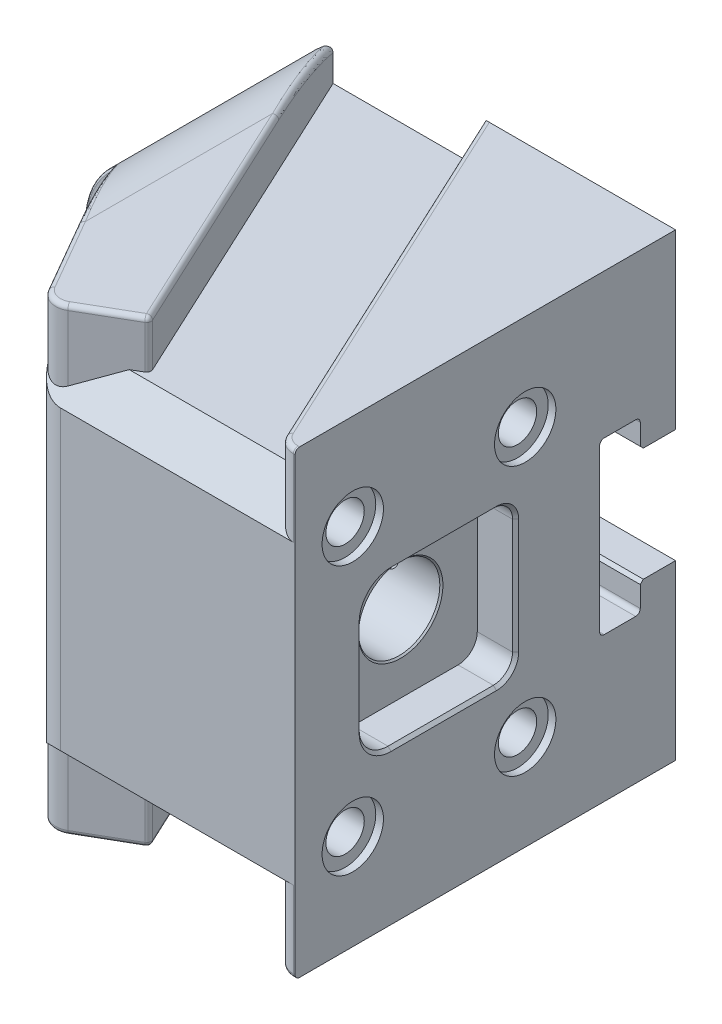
SolidWorks part; units mm, degrees
ref_plane "Front Plane" through (0, 0, 0) normal (0, 0, 1) x (1, 0, 0)
ref_plane "Top Plane" through (0, 0, 0) normal (0, 1, 0) x (1, 0, 0)
ref_plane "Right Plane" through (0, 0, 0) normal (1, 0, 0) x (0, 0, -1)
sketch "Sketch1" plane through (0, 0, 0) normal (1, 0, 0) x (0, 0, -1)
  line L1 (0, 38.0365) -> (-63.5, 38.0365)
  line L2 (-13.081, -14.097) -> (-13.081, 14.097)
  line L3 (-63.5, 38.0365) -> (-63.5, -38.0365)
  line L5 (-25.4931, 0) -> (10.3829, 0) construction
  line L6 (34.925, 0) -> (-34.925, 0) construction
  line L7 (0, 38.0365) -> (0, 9.398)
  line L8 (0, 9.398) -> (-6.35, 9.398)
  line L9 (-6.35, 9.398) -> (-6.35, 14.097)
  line L10 (-6.35, 14.097) -> (-13.081, 14.097)
  line L11 (-6.35, -9.398) -> (-6.35, -14.097)
  line L12 (-6.35, -14.097) -> (-13.081, -14.097)
  line L13 (0, -9.398) -> (-6.35, -9.398)
  line L15 (-31.814, -38.0365) -> (-63.5, -38.0365)
  line L16 (0, -9.398) -> (0, -38.0365)
  line L17 (0, -38.0365) -> (-31.814, -38.0365)
  line L18 (0, 34.925) -> (0, -34.925) construction
  dimension "D1" = 13.081
  dimension "D2" = 63.5
  dimension "D3" = 28.194
  dimension "D4" = 6.35
  dimension "D5" = 18.796
  dimension "D6" = 76.073
  dimension "D7" = 38.0365
extrude "Extrude1" add sketch "Sketch1" against normal blind 63.5
sketch "Sketch2" plane through (0, 0, 0) normal (0, 1, 0) x (1, 0, 0)
  line L0 (-67.4703, -34.925) -> (-58.568, -34.925)
  line L1 (-58.568, -34.925) -> (-42.0703, -63.5)
  line L2 (-42.0703, -63.5) -> (-67.4703, -63.5)
  line L3 (-67.4703, -63.5) -> (-67.4703, -34.925)
  line L4 (-63.5, -63.5) -> (0, -63.5) construction
  line L5 (-63.5, 0) -> (0, 0) construction
  line L7 (-58.568, -34.925) -> (-78.5624, -0.2938) construction
  line L8 (-63.5, -5.5753) -> (-63.5, 4.1784) construction
  line L10 (0, -63.5) -> (0, 0) construction
  circle A0 centre (-69.0753, -5.5753) radius 5.5753 construction
  dimension "D5" = 11.1506
  dimension "D1" = 63.5
  dimension "D2" = 120
  dimension "D3" = 28.575
  dimension "D4" = 25.4
extrude "Cut-Extrude1" cut sketch "Sketch2" against normal mid plane 76.2
sketch "Sketch3" plane through (0, 0, 13.081) normal (0, 0, -1) x (-1, 0, 0)
  line L0 (0, -38.0365) -> (0, -9.398) construction
  line L1 (34.925, 0) -> (-34.925, 0) construction
  circle A0 centre (19.05, 0) radius 9.525
  dimension "D1" = 19.05
  dimension "D2" = 19.05
extrude "Cut-Extrude2" cut sketch "Sketch3" against normal blind 12.7
sketch "Sketch4" plane through (0, 0, 13.081) normal (0, 0, -1) x (-1, 0, 0)
  circle A0 centre (19.05, 0) radius 9.525 construction
  circle A1 centre (19.05, 0) radius 9.525
extrude "Cut-Extrude3" cut sketch "Sketch4" along normal blind 33.02
sketch "Sketch5" plane through (0, 0, 25.781) normal (0, 0, -1) x (-1, 0, 0)
  line L0 (19.05, 7.8891) -> (19.05, -9.3784) construction
  line L1 (34.925, 0) -> (-34.925, 0) construction
  line L2 (0, -14.097) -> (0, 14.097) construction
  circle A0 centre (15.24, 0) radius 1.7272
  circle A1 centre (22.86, 0) radius 1.7272
  dimension "D2" = 3.4544
  dimension "D1" = 19.05
  dimension "D3" = 3.81
extrude "Cut-Extrude4" cut sketch "Sketch5" against normal blind 8.636
sketch "Sketch6" plane through (0, 0, 0) normal (0, 1, 0) x (1, 0, 0)
  line L0 (-18.9934, -39.6748) -> (-43.2874, -39.6748) construction
  line L2 (-31.1404, -32.9311) -> (-31.1404, -29.3624)
  line L3 (-31.1404, -29.3624) -> (-68.8805, -29.3624)
  line L4 (-68.8805, -29.3624) -> (-68.8805, -39.6748)
  line L5 (-31.1404, -32.9311) -> (0, -32.9311)
  line L6 (0, -32.9311) -> (0, -39.6748)
  line L7 (0, -39.6748) -> (-68.8805, -39.6748)
  line L9 (0, -63.5) -> (0, 0) construction
  line L10 (-42.0703, -63.5) -> (0, -63.5) construction
  dimension "D1" = 23.8252
  dimension "D2" = 68.8805
  dimension "D3" = 20.6248
  dimension "D4" = 13.4874
  dimension "D5" = 31.1404
revolve "Cut-Revolve1" cut sketch "Sketch6" angle 360 about L0
fillet "Fillet1" radius 0.762 4 edges at (-31.75, 14.097, 6.35) (-31.75, -14.097, 6.35) (-31.75, -14.097, 13.081) (-31.75, 14.097, 13.081)
chamfer "Chamfer1" distance 0.508 angle 45 4 edges at (-42.0501, 9.398, 6.35) (-42.0501, 9.398, 0) (-42.0501, -9.398, 0) (-42.0501, -9.398, 6.35)
sketch "Sketch8" plane through (0, 38.0365, 0) normal (0, 1, 0) x (1, 0, 0)
  line L0 (-2.2944, -63.5) -> (-33.0894, 2.54)
  line L1 (-33.0894, 2.54) -> (-58.3966, 2.54)
  line L2 (-58.3966, 2.54) -> (-30.8102, -56.6193)
  line L3 (-42.7279, -63.5) -> (-2.2944, -63.5)
  line L4 (0, -63.5) -> (0, 0) construction
  line L5 (-42.0703, -63.5) -> (0, -63.5) construction
  line L6 (-30.8102, -56.6193) -> (-42.7279, -63.5)
  line L7 (-63.5, 0) -> (0, 0) construction
  line L8 (0, 0) -> (0, -63.5) construction
  line L9 (-19.05, -5.0025) -> (-19.05, 7.814) construction
  circle A0 centre (-24.0525, -5.0025) radius 5.0025 construction
  dimension "D7" = 10.0051
  dimension "D8" = 2.2944
  dimension "D1" = 25
  dimension "D2" = 66.04
  dimension "D3" = 30.8102
  dimension "D4" = 22.9362
  dimension "D5" = 30
  dimension "D6" = 19.05
extrude "Cut-Extrude6" cut sketch "Sketch8" against normal blind 7.874
mirror "Mirror1" about plane through (0, 0, 0) normal (0, 1, 0) of "Cut-Extrude6"
fillet "Fillet5" radius 0.762 2 edges at (-30.8102, 34.0995, 56.6193) (-30.8102, -34.0995, 56.6193)
chamfer "Chamfer2" distance 5.588 angle 45 2 edges at (-22.1823, -30.1625, 63.5) (-22.1823, 30.1625, 63.5)
fillet "Fillet6" radius 3.175 2 edges at (-2.2944, -31.3055, 63.5) (-2.2944, 31.3055, 63.5)
sketch "Sketch9" plane through (0, 0, 0) normal (1, 0, 0) x (0, 0, -1)
  line L0 (-52.3875, 12.7) -> (-26.9875, 12.7)
  line L1 (-26.9875, 12.7) -> (-26.9875, -12.7)
  line L2 (-26.9875, -12.7) -> (-52.3875, -12.7)
  line L3 (-52.3875, -12.7) -> (-52.3875, 12.7)
  line L4 (34.925, 0) -> (-34.925, 0) construction
  dimension "D1" = 25.4
  dimension "D2" = 25.4
  dimension "D3" = 12.7
  dimension "D4" = 26.9875
extrude "Cut-Extrude7" cut sketch "Sketch9" against normal blind 6.35
fillet "Fillet8" radius 13.462 2 edges at (-63.5, -38.0365, 17.4625) (-63.5, 38.0365, 17.4625)
chamfer "Chamfer3" distance 0.508 angle 45 8 edges at (0, -23.9712, 0) (-15.9525, -38.0365, 0) (-61.8237, -31.0801, 0) (-63.5, -17.2402, 0) (0, 23.9712, 0) (-63.5, 17.2403, 0) (-61.8237, 31.0801, 0) (-15.9525, 38.0365, 0)
fillet "Fillet10" radius 0.381 4 edges at (-62.2047, -30.3362, 34.925) (-62.2047, 30.3362, 34.925) (-63.5, -16.864, 34.925) (-63.5, 16.864, 34.925)
fillet "Fillet11" radius 0.127 4 edges at (-58.6326, 34.7907, 34.8132) (-58.6338, -34.7925, 34.811) (-58.568, 21.8226, 34.925) (-58.568, -21.8226, 34.925)
fillet "Fillet12" radius 3.175 2 edges at (-3.175, -12.7, 26.9875) (-3.175, 12.7, 26.9875)
chamfer "Chamfer5" distance 0.254 angle 45 1 edges at (-6.35, 0, 46.4185)
fillet "Fillet13" radius 4.7752 2 edges at (-3.175, 12.7, 52.3875) (-3.175, -12.7, 52.3875)
ref_plane "Plane1" through (0, -22.225, 0) normal (0, 1, 0) x (-1, 0, 0)
sketch "Sketch11" plane through (0, -22.225, 0) normal (0, 1, 0) x (-1, 0, 0)
  line L0 (13.97, 51.9073) -> (13.97, -7.1622) construction
  line L1 (0, 63.5) -> (0, 0.508) construction
  line L2 (13.97, 58.4023) -> (18.3388, 55.88)
  line L3 (18.3388, 55.88) -> (18.3388, -5.9689)
  line L4 (18.3388, -5.9689) -> (13.97, -5.9689)
  line L5 (13.97, -5.9689) -> (13.97, 58.4023)
  line L7 (0.508, 0) -> (31.9049, 0) construction
  dimension "D1" = 13.97
  dimension "D2" = 8.7376
  dimension "D3" = 55.88
  dimension "D4" = 120
  dimension "D5" = 64.3712
revolve "Cut-Revolve2" cut sketch "Sketch11" angle 360 about L0
mirror "Mirror2" about plane through (0, 0, 0) normal (0, 1, 0) of "Cut-Revolve2"
sketch "Sketch12" plane through (0, -22.225, 0) normal (0, 1, 0) x (-1, 0, 0)
  line L0 (72.3809, 25.4) -> (5.3464, 25.4) construction
  line L1 (77.5927, 39.6748) -> (-16.2197, 39.6748) construction
  line L2 (42.0703, 63.5) -> (0.2717, 63.5) construction
  line L3 (70.5837, 21.0312) -> (13.97, 21.0312)
  line L4 (13.97, 21.0312) -> (13.97, 25.4)
  line L5 (13.97, 25.4) -> (70.5837, 25.4)
  line L6 (70.5837, 25.4) -> (70.5837, 21.0312)
  line L7 (0, 63.5) -> (0, 0.508) construction
  dimension "D1" = 23.8252
  dimension "D2" = 14.2748
  dimension "D3" = 8.7376
  dimension "D4" = 13.97
  dimension "D5" = 56.6137
revolve "Cut-Revolve3" cut sketch "Sketch12" angle 360 about L0
mirror "Mirror3" about plane through (0, 0, 0) normal (0, 1, 0) of "Cut-Revolve3"
sketch "Sketch14" plane through (0, 0, 0) normal (1, 0, 0) x (0, 0, -1)
  line L0 (34.925, 0) -> (-34.925, 0) construction
  circle A0 centre (-25.4, 22.225) radius 3.175
  circle A1 centre (-39.6748, 0) radius 6.9977 construction
  circle A2 centre (-53.9496, 22.225) radius 3.175
  dimension "D1" = 14.2748
  dimension "D3" = 6.35
  dimension "D5" = 6.35
  dimension "D2" = 22.225
  dimension "D4" = 14.2748
  dimension "D6" = 22.225
extrude "Cut-Extrude8" cut sketch "Sketch14" against normal blind 13.97
mirror "Mirror4" about plane through (0, 0, 0) normal (0, 1, 0) of "Cut-Extrude8"
sketch "Sketch15" plane through (0, 0, 0) normal (1, 0, 0) x (0, 0, -1)
  circle A1 centre (-25.4, 22.225) radius 5.08
  circle A2 centre (-53.9496, 22.225) radius 5.08
  dimension "D1" = 10.16
  dimension "D2" = 10.16
extrude "Cut-Extrude9" cut sketch "Sketch15" against normal blind 1.27
mirror "Mirror5" about plane through (0, 0, 0) normal (0, 1, 0) of "Cut-Extrude9"
fillet "Fillet14" radius 3.175 2 edges at (-42.2347, 31.4479, 63.2152) (-42.2347, -31.4479, 63.2152)
fillet "Fillet15" radius 5.5626 1 edges at (-42.0703, 0, 63.5)
fillet "Fillet16" radius 0.762 22 edges at (-0.1358, -38.0365, 63.5) (-1.9776, -38.0365, 63.0028) (-53.6378, -37.5463, 7.6655) (-58.7822, -34.81, 34.601) (-54.642, -37.2247, 41.7251) (-46.9301, -38.0365, 55.0825) (-41.8943, -38.0365, 61.9449) (-35.45, -38.0365, 59.2981) (-31.0692, -38.0365, 56.5377) (-0.1358, 38.0365, 63.5) (-1.9776, 38.0365, 63.0028) (-53.6378, 37.5463, 7.6655) (-58.7751, 34.816, 34.6076) (-54.642, 37.2247, 41.7251) (-46.9301, 38.0365, 55.0825) (-41.8943, 38.0365, 61.9449) (-35.45, 38.0365, 59.2981) (-31.0692, 38.0365, 56.5377) (-17.4086, -38.0365, 31.0874) (-40.5716, -38.0365, 35.6858) (-17.4086, 38.0365, 31.0874) (-40.5716, 38.0365, 35.6858)
chamfer "Chamfer7" distance 0.508 angle 45 8 edges at (0, 0, 26.9875) (0, 11.7701, 27.9174) (0, -11.7701, 27.9174) (0, 12.7, 38.8874) (0, -12.7, 38.8874) (0, 11.3014, 50.9889) (0, -11.3014, 50.9889) (0, 0, 52.3875)
